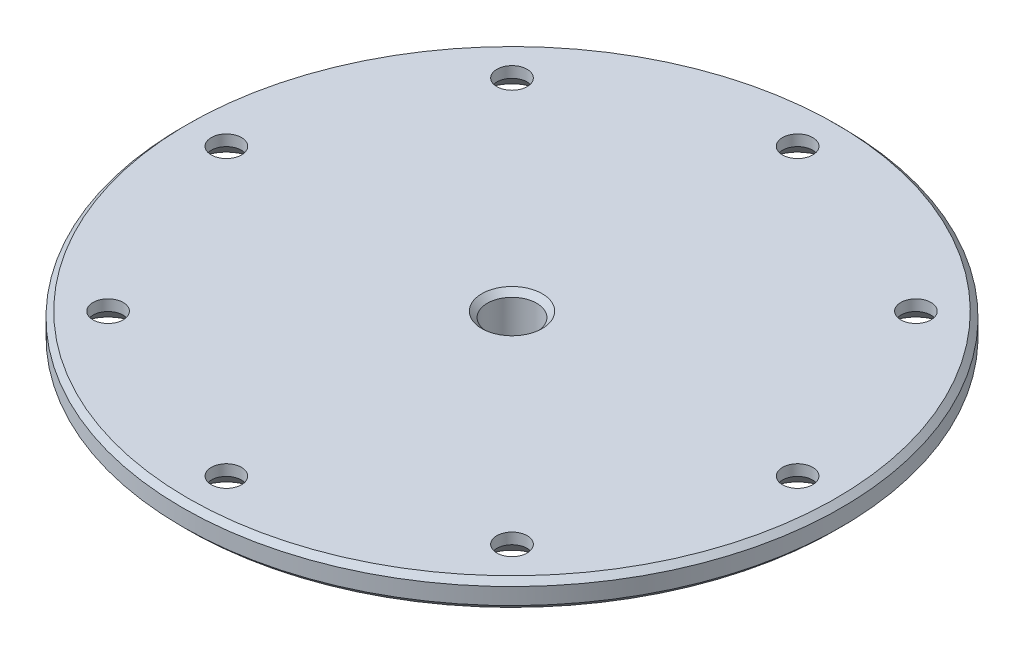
SolidWorks part; units mm, degrees
ref_plane "Plan de face" through (0, 0, 0) normal (0, 0, 1) x (1, 0, 0)
ref_plane "Plan de dessus" through (0, 0, 0) normal (0, 1, 0) x (1, 0, 0)
ref_plane "Plan de droite" through (0, 0, 0) normal (1, 0, 0) x (0, 0, -1)
sketch "Esquisse1" plane through (0, 0, 0) normal (0, 0, 1) x (1, 0, 0)
  line L0 (0, 0) -> (0, 74.4771) construction
  line L1 (0, 74.4771) -> (0, -66.1089) construction
  line L2 (0, 0) -> (15, 0)
  line L3 (15, 0) -> (15, 6)
  line L4 (15, 6) -> (22, 6)
  line L5 (22, 6) -> (22, 11)
  line L6 (22, 11) -> (60, 11)
  line L7 (60, 11) -> (60, 16)
  line L8 (60, 16) -> (0, 16)
  line L9 (0, 16) -> (0, 0)
  dimension "D1" = 15
  dimension "D2" = 7
  dimension "D3" = 60
  dimension "D4" = 5
  dimension "D5" = 5
  dimension "D6" = 6
revolve "Révolution1" add sketch "Esquisse1" angle 360 about L0
chamfer "Chanfrein2" distance 1 angle 45 4 edges at (0, 0, -15) (0, 6, -22) (0, 11, -60) (0, 16, -60)
sketch "Esquisse2" plane through (0, 16, 0) normal (0, 1, 0) x (1, 0, 0)
  circle A0 centre (0, 0) radius 4.5
  dimension "D1" = 9
extrude "Enlèv. mat.-Extru.1" cut sketch "Esquisse2" against normal through all
sketch "Esquisse3" plane through (0, 16, 0) normal (0, 1, 0) x (1, 0, 0)
  line L0 (0, 0) -> (0, 63.143) construction
  line L1 (0, 0) -> (47.3088, 47.3088) construction
  circle A0 centre (0, 0) radius 52 construction
  circle A1 centre (0, 52) radius 2.75
  dimension "D2" = 104
  dimension "D3" = 5.5
  dimension "D1" = 45
extrude "Enlèv. mat.-Extru.2" cut sketch "Esquisse3" against normal through all
pattern_circular "Répétition circulaire1" count 8 over 360 about axis through (0, 0, 0) along (0, 1, 0) of "Enlèv. mat.-Extru.2"
chamfer "Chanfrein4" distance 3 angle 45 8 edges at (52, 11, -2.75) (36.7696, 11, 34.0196) (0, 11, 49.25) (-36.7696, 11, 34.0196) (-52, 11, -2.75) (-36.7696, 11, -39.5196) (0, 11, -54.75) (36.7696, 11, -39.5196)
chamfer "Chanfrein5" distance 1 angle 45 1 edges at (0, 16, 4.5)
chamfer "Chanfrein6" distance 1 angle 45 1 edges at (0, 0, 4.5)
